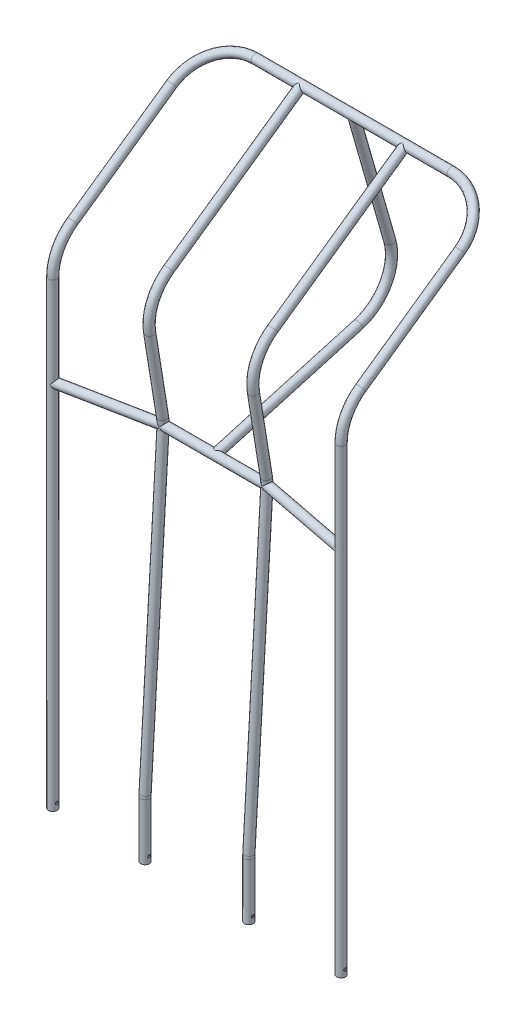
SolidWorks part; units mm, degrees
ref_plane "Front Plane" through (0, 0, 0) normal (0, 0, 1) x (1, 0, 0)
ref_plane "Top Plane" through (0, 0, 0) normal (0, 1, 0) x (1, 0, 0)
ref_plane "Right Plane" through (0, 0, 0) normal (1, 0, 0) x (0, 0, -1)
sketch3d "3DSketch1"
  line L9 (-317.5, 0, 0) -> (317.5, 0, 0) construction
  line L10 (-317.5, 0, 0) -> (-317.5, 1013.9104, 0)
  line L11 (-317.5, 1066.8, 0) -> (317.5, 1066.8, 0) construction
  line L12 (317.5, 0, 0) -> (317.5, 1013.9104, 0)
  line L13 (-215.9, 1308.1, -344.6121) -> (215.9, 1308.1, -344.6121)
  line L14 (-317.5, 1249.8246, -261.3863) -> (-317.5, 1097.1362, -43.3246)
  line L15 (-317.5, 1066.8, 0) -> (317.5, 1066.8, 0) construction
  line L16 (317.5, 1249.8246, -261.3863) -> (317.5, 1097.1362, -43.3246)
  arc A0 (215.9, 1308.1, -344.6121) -> (317.5, 1249.8246, -261.3863) centre (215.9, 1249.8246, -261.3863) ccw
  arc A1 (-215.9, 1308.1, -344.6121) -> (-317.5, 1249.8246, -261.3863) centre (-215.9, 1249.8246, -261.3863) ccw
  arc A2 (317.5, 1013.9104, 0) -> (317.5, 1097.1362, -43.3246) centre (317.5, 1013.9104, -101.6) ccw
  arc A3 (-317.5, 1013.9104, 0) -> (-317.5, 1097.1362, -43.3246) centre (-317.5, 1013.9104, -101.6) ccw
  point P4 (0, 0, 0)
  point P16 (317.5, 1308.1, -344.6121)
  point P17 (215.9, 1166.5988, -319.6616)
  point P20 (-317.5, 1308.1, -344.6121)
  point P21 (-215.9, 1333.0505, -203.1109)
  point P24 (317.5, 1066.8, 0)
  point P26 (215.9, 1013.9104, -101.6)
  point P29 (-317.5, 1066.8, 0)
  point P31 (-419.1, 1013.9104, -101.6)
  dimension "D5" = 101.6
  dimension "D6" = 101.6
  dimension "D1" = 1066.8
  dimension "D2" = 635
  dimension "D4" = 1308.1
  dimension "D3" = 55
ref_plane "offselt_up" through (0, 812.8, 0) normal (0, 1, 0) x (1, 0, 0)
ref_plane "offset right" through (114.3, 0, 0) normal (1, 0, 0) x (0, 0, -1)
ref_plane "offset left" through (-114.3, 0, 0) normal (1, 0, 0) x (0, 0, -1)
sketch "Sketch2" plane through (-114.3, 0, 0) normal (1, 0, 0) x (0, 0, -1)
  line L0 (0, 0) -> (0, 1013.9104) construction
  line L1 (0, 0) -> (0, 124.0478)
  line L2 (39.5448, 806.9006) -> (0.1714, 129.9472)
  line L3 (38.4159, 829.0033) -> (10.1598, 1003.9105)
  line L4 (52.184, 1103.3396) -> (344.6121, 1308.1)
  line L5 (261.3863, 1249.8246) -> (43.3246, 1097.1362) construction
  line L6 (284.305, 812.8) -> (-284.305, 812.8) construction
  circle A0 centre (0, 520.7) radius 9.525
  arc A1 (0, 124.0478) -> (0.1714, 129.9472) centre (101.6, 124.0478) cw
  arc A2 (52.184, 1103.3396) -> (10.1598, 1003.9105) centre (110.4594, 1020.1138) ccw
  arc A3 (39.5448, 806.9006) -> (38.4159, 829.0033) centre (-61.8838, 812.8) ccw
  point P12 (0, 127)
  point P28 (0, 1066.8)
sketch "Sketch3" plane through (114.3, 0, 0) normal (1, 0, 0) x (0, 0, -1)
  line L0 (0, 0) -> (0, 1013.9104) construction
  line L1 (0, 0) -> (0, 124.0478)
  line L2 (39.5448, 806.9006) -> (0.1714, 129.9472)
  line L3 (38.4159, 829.0033) -> (10.1598, 1003.9105)
  line L4 (52.184, 1103.3396) -> (344.6121, 1308.1)
  circle A0 centre (0, 520.7) radius 9.525
  arc A1 (0, 124.0478) -> (0.1714, 129.9472) centre (101.6, 124.0478) cw
  arc A2 (52.184, 1103.3396) -> (10.1598, 1003.9105) centre (110.4594, 1020.1138) ccw
  arc A3 (39.5448, 806.9006) -> (38.4159, 829.0033) centre (-61.8838, 812.8) ccw
  point P12 (0, 127)
  point P28 (0, 1066.8)
sketch "Sketch5" plane through (0, 812.8, 0) normal (0, 1, 0) x (1, 0, 0)
  line L0 (-317.5, 0) -> (-114.3, 39.7162)
  line L1 (-114.3, 39.7162) -> (114.3, 39.7162)
  line L2 (114.3, 39.7162) -> (317.5, 0)
sketch "Sketch6" plane through (0, 0, 0) normal (1, 0, 0) x (0, 0, -1)
  line L0 (344.6121, 1308.1) -> (424.6771, 1028.8802)
  line L1 (355.0177, 903.2112) -> (39.7162, 812.8)
  line L2 (52.184, 1103.3396) -> (344.6121, 1308.1) construction
  arc A0 (424.6771, 1028.8802) -> (355.0177, 903.2112) centre (327.0129, 1000.8754) cw
  dimension "D3" = 101.6
  dimension "D1" = 71
  dimension "D2" = 90
other "Al round tubing 0.75 OD X 0.083 WALL(1)"
ref_plane "Plane1" through (-317.5, 0, 0) normal (0, 1, 0) x (1, 0, 0)
sketch "Sketch1" plane through (-317.5, 0, 0) normal (0, 1, 0) x (1, 0, 0)
  circle A0 centre (0, 0) radius 7.4168
  circle A1 centre (0, 0) radius 9.525
  point P3 (0, 0)
  dimension "In_dia" = 14.8336
  dimension "Out_dia" = 19.05
sketch "Sketch7" plane through (0, 0, 0) normal (1, 0, 0) x (0, 0, -1)
  line L0 (0, 0) -> (0, 1013.9104) construction
  circle A0 centre (0, 14.2875) radius 3.2639
  dimension "D1" = 6.5278
  dimension "D2" = 14.2875
extrude "Cut-Extrude1" cut sketch "Sketch7" against normal through all and the other way through all
equation "\"offsetr\"=4.5"
equation "\"D1@offset right\"=\"offsetr\""
equation "\"D1@offset left\"=\"offsetr\""
equation "\"D6@Sketch2\"=0.525+0.375"
